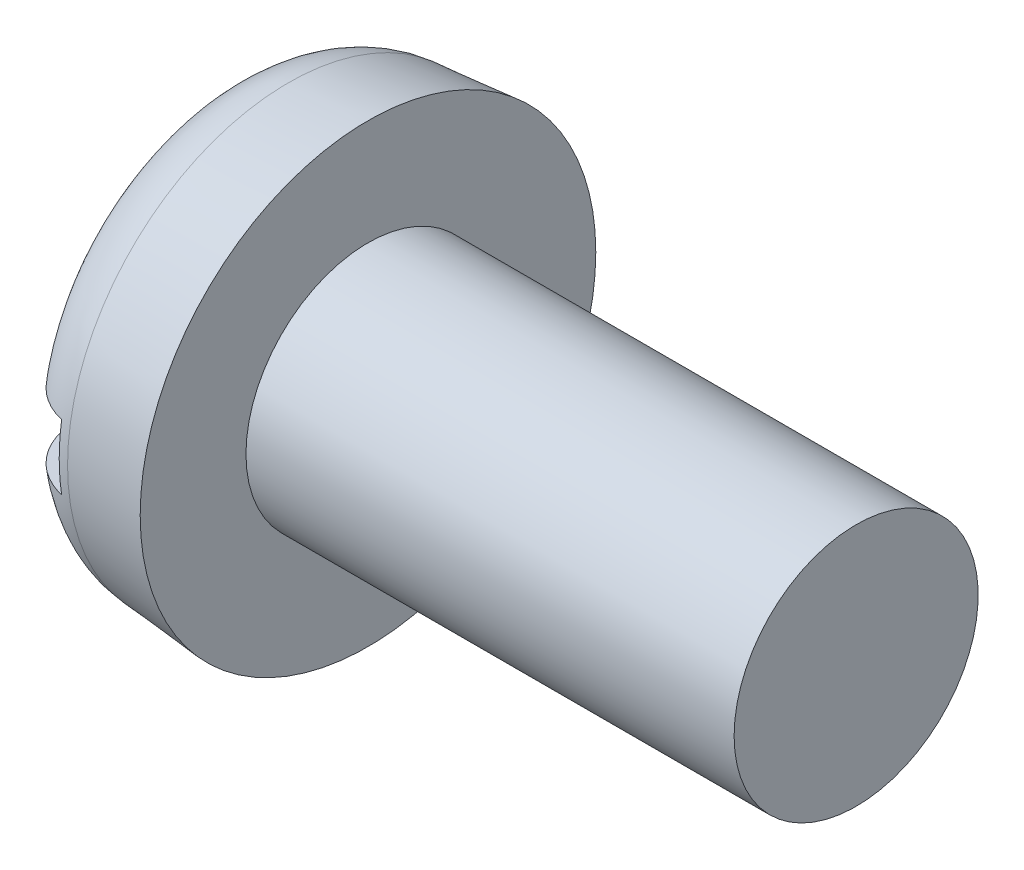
SolidWorks part; units mm, degrees
ref_plane "Plane1" through (0, 0, 0) normal (0, 0, 1) x (1, 0, 0)
ref_plane "Plane2" through (0, 0, 0) normal (0, 1, 0) x (1, 0, 0)
ref_plane "Plane3" through (0, 0, 0) normal (1, 0, 0) x (0, 0, -1)
sketch "BodySke" plane through (0, 0, 0) normal (0, 0, 1) x (1, 0, 0)
  line L0 (1.8, 1.5) -> (1.8, 2.8)
  line L1 (0, 0) -> (0, 2.6425)
  line L2 (-25.4, 0) -> (127, 0) construction
  line L3 (7.8, 0) -> (0, 0)
  line L4 (1.8, 1.5) -> (7.8, 1.5)
  line L5 (7.8, 1.5) -> (7.8, 0)
  line L6 (0, 2.6425) -> (1.8, 2.8)
  line L9 (2.3, 3.0875) -> (2.3, -6.4375) construction
  line L10 (1.8, 6.35) -> (1.8, -3.175) construction
  dimension "Head_ht" = 1.8
  dimension "Diameter" = 3
  dimension "Length" = 6
  dimension "Head_dia" = 5.6
  dimension "Advance" = 0.5
  dimension "Thread_nom" = 6
  dimension "Head_side_angle" = 5
revolve "Base-Revolve" add sketch "BodySke"
fillet "Fillet1" [suppressed] radius 0.1
fillet "Fillet2" radius 0.9 1 edges at (0, 0, 2.6425)
sketch "Sketch2" plane through (0, 0, 0) normal (1, 0, 0) x (0, 0, -1)
  line L0 (2.8, -0.4) -> (-2.8, -0.4)
  line L1 (2.8, -0.4) -> (2.8, 0.4)
  line L2 (-2.8, 0.4) -> (2.8, 0.4)
  line L3 (-2.8, 0.4) -> (-2.8, -0.4)
  dimension "D1" = 5.6
  dimension "D2" = 2.8
  dimension "Slot_width" = 0.8
  dimension "D3" = 0.4
extrude "Slot" cut sketch "Sketch2" along normal blind 0.7
sketch "ThdSchSke" plane through (0, 0, 0) normal (0, 0, 1) x (1, 0, 0)
  line L0 (2.8, -1.2195) -> (2.6036, -1.5)
  line L1 (2.8, -1.2195) -> (2.9964, -1.5)
  line L2 (2.9964, -1.5) -> (2.9964, -1.875)
  line L3 (-3.175, 0) -> (5.1513, 0) construction
  line L5 (2.9964, -1.875) -> (2.6036, -1.875)
  line L6 (2.6036, -1.875) -> (2.6036, -1.5)
  dimension "Thread_minor" = 2.439
  dimension "Diameter" = 3
  dimension "Start" = 2.8
  dimension "SideAngle" = 55
  dimension "VeeAngle" = 70
  dimension "Overcut" = 3.75
revolve "ThreadSchematic" [suppressed] cut sketch "ThdSchSke" angle 360 about L3
pattern_linear "ThdSchPat" [suppressed]
equation "\"D1@Sketch2\" = \"Head_dia@BodySke\""
equation "\"D2@Sketch2\" = \"D1@Sketch2\" / 2"
equation "\"D3@Sketch2\" = \"Slot_width@Sketch2\" / 2"
equation "\"Thread_length@ThreadCosmetic\" = ((sgn( (\"Length@BodySke\" - \"Advance@BodySke\" * 2.0 ) - \"Thread_nom@BodySke\" )-1)*( (\"Length@BodySke\" - \"Advance@BodySke\"  * 2.0) - \"Thread_nom@BodySke\" ))/-2+ \"Thread_"
equation "\"Thread_minor@ThdSchSke\" = \"Thread_minor@ThreadCosmetic\""
equation "\"Diameter@ThdSchSke\" = \"Diameter@BodySke\""
equation "\"Overcut@ThdSchSke\" = \"Diameter@BodySke\" * 1.25"
equation "\"Start@ThdSchSke\" = \"Head_ht@BodySke\" + \"Length@BodySke\" - \"Thread_length@ThreadCosmetic\"  '---Non-countersunk---"
equation "\"Num_threads@ThdSchPat\" = int( \"Thread_length@ThreadCosmetic\" / \"Advance@BodySke\" + 0.999 )  + 1"
equation "\"Advance@ThdSchPat\" = \"Thread_length@ThreadCosmetic\" /  (\"Num_threads@ThdSchPat\" - 1) 'relax it"
